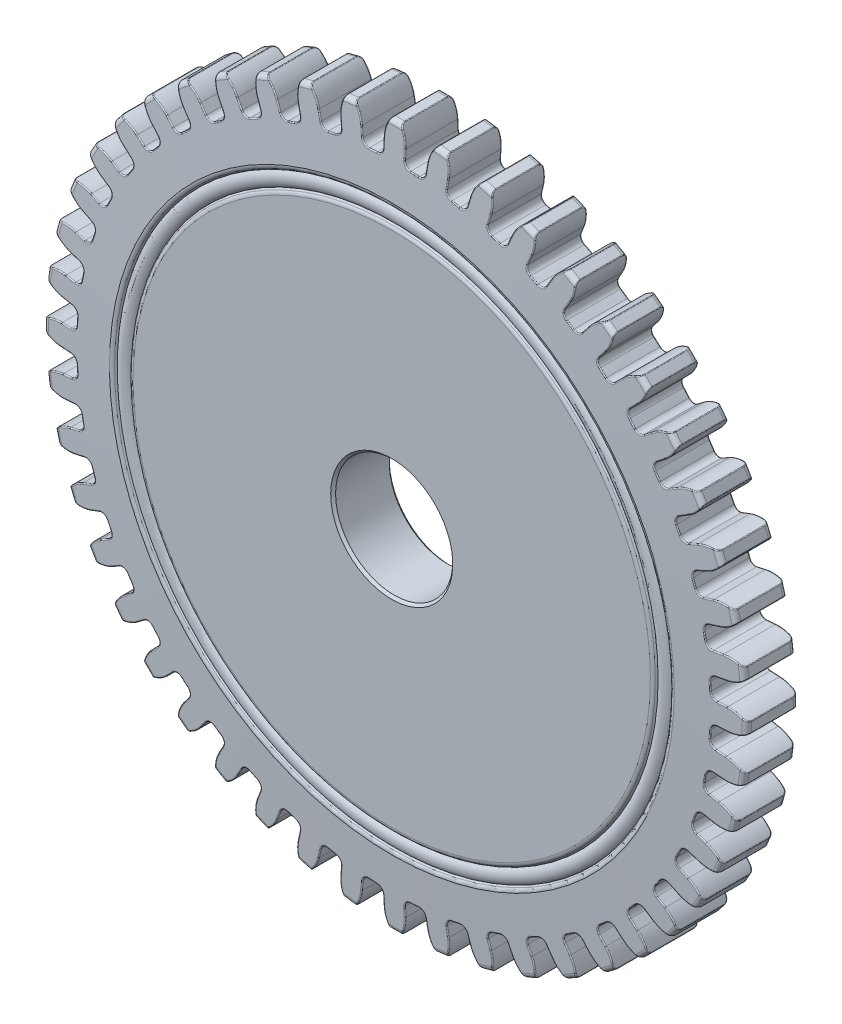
SolidWorks part; units mm, degrees
ref_plane "Спереди" through (0, 0, 0) normal (0, 0, 1) x (1, 0, 0)
ref_plane "Сверху" through (0, 0, 0) normal (0, 1, 0) x (1, 0, 0)
ref_plane "Справа" through (0, 0, 0) normal (1, 0, 0) x (0, 0, -1)
sketch "Эскиз1" plane through (0, 0, 0) normal (1, 0, 0) x (0, 0, -1)
  line L0 (0, 0) -> (8.0775, 0) construction
  line L1 (0, 0) -> (0, 36) construction
  line L2 (3, 6) -> (-3, 6)
  line L3 (-2.625, 36) -> (2.625, 36)
  line L4 (2.7071, 28.4071) -> (3, 28.7)
  line L5 (2.7071, 26.9929) -> (3, 26.7)
  line L6 (3, 6) -> (3, 26.7)
  line L7 (3, 28.7) -> (2.625, 36)
  line L8 (-3, 6) -> (-3, 26.7)
  line L9 (-2.7071, 26.9929) -> (-3, 26.7)
  line L10 (-2.7071, 28.4071) -> (-3, 28.7)
  line L11 (-3, 28.7) -> (-2.625, 36)
  arc A0 (2.7071, 26.9929) -> (2.7071, 28.4071) centre (2, 27.7) ccw
  arc A1 (-2.7071, 26.9929) -> (-2.7071, 28.4071) centre (-2, 27.7) cw
  point P9 (0, 6)
  dimension "D2" = 2
  dimension "D1" = 8.3
  dimension "D3" = 5.25
  dimension "D4" = 36
  dimension "D5" = 90
  dimension "D6" = 6
  dimension "D7" = 12
revolve "Повернуть1" add sketch "Эскиз1" angle 360 about L0
fillet "Скругление1" radius 0.5 4 edges at (36, 0, -2.625) (36, 0, 2.625) (26.7, 0, 3) (28.7, 0, 3)
chamfer "Фаска1" distance 0.25 angle 45 2 edges at (6, 0, 3) (6, 0, -3)
sketch "Эскиз2" plane through (0, 0, 0) normal (0, 0, 1) x (1, 0, 0)
  line L0 (0, 0) -> (0, 36) construction
  line L1 (-1.1, 34.0817) -> (-1.1, 33.0895)
  line L2 (1.1, 34.0817) -> (1.1, 33.0895)
  line L3 (3.358, 33.9337) -> (3.2285, 32.95)
  line L4 (5.5391, 33.6465) -> (5.4096, 32.6629)
  line L5 (7.7585, 33.2051) -> (7.5017, 32.2467)
  line L6 (9.8835, 32.6356) -> (9.6267, 31.6773)
  line L7 (12.0262, 31.9083) -> (11.6466, 30.9917)
  line L8 (14.0588, 31.0664) -> (13.6791, 30.1498)
  line L9 (16.0882, 30.0656) -> (15.5921, 29.2064)
  line L10 (17.9935, 28.9656) -> (17.4974, 28.1064)
  line L11 (19.8749, 27.7084) -> (19.271, 26.9213)
  line L12 (21.6203, 26.3692) -> (21.0163, 25.5821)
  line L13 (23.3216, 24.8772) -> (22.62, 24.1757)
  line L14 (24.8772, 23.3216) -> (24.1757, 22.62)
  line L15 (26.3692, 21.6203) -> (25.5821, 21.0163)
  line L16 (27.7084, 19.8749) -> (26.9213, 19.271)
  line L17 (28.9656, 17.9935) -> (28.1064, 17.4974)
  line L18 (30.0656, 16.0882) -> (29.2064, 15.5921)
  line L19 (31.0664, 14.0588) -> (30.1498, 13.6791)
  line L20 (31.9083, 12.0262) -> (30.9917, 11.6466)
  line L21 (32.6356, 9.8835) -> (31.6773, 9.6267)
  line L22 (33.2051, 7.7585) -> (32.2467, 7.5017)
  line L23 (33.6465, 5.5391) -> (32.6629, 5.4096)
  line L24 (33.9337, 3.358) -> (32.95, 3.2285)
  line L25 (34.0817, 1.1) -> (33.0895, 1.1)
  line L26 (34.0817, -1.1) -> (33.0895, -1.1)
  line L27 (33.9337, -3.358) -> (32.95, -3.2285)
  line L28 (33.6465, -5.5391) -> (32.6629, -5.4096)
  line L29 (33.2051, -7.7585) -> (32.2467, -7.5017)
  line L30 (32.6356, -9.8835) -> (31.6773, -9.6267)
  line L31 (31.9083, -12.0262) -> (30.9917, -11.6466)
  line L32 (31.0664, -14.0588) -> (30.1498, -13.6791)
  line L33 (30.0656, -16.0882) -> (29.2064, -15.5921)
  line L34 (28.9656, -17.9935) -> (28.1064, -17.4974)
  line L35 (27.7084, -19.8749) -> (26.9213, -19.271)
  line L36 (26.3692, -21.6203) -> (25.5821, -21.0163)
  line L37 (24.8772, -23.3216) -> (24.1757, -22.62)
  line L38 (23.3216, -24.8772) -> (22.62, -24.1757)
  line L39 (21.6203, -26.3692) -> (21.0163, -25.5821)
  line L40 (19.8749, -27.7084) -> (19.271, -26.9213)
  line L41 (17.9935, -28.9656) -> (17.4974, -28.1064)
  line L42 (16.0882, -30.0656) -> (15.5921, -29.2064)
  line L43 (14.0588, -31.0664) -> (13.6791, -30.1498)
  line L44 (12.0262, -31.9083) -> (11.6466, -30.9917)
  line L45 (9.8835, -32.6356) -> (9.6267, -31.6773)
  line L46 (7.7585, -33.2051) -> (7.5017, -32.2467)
  line L47 (5.5391, -33.6465) -> (5.4096, -32.6629)
  line L48 (3.358, -33.9337) -> (3.2285, -32.95)
  line L49 (1.1, -34.0817) -> (1.1, -33.0895)
  line L50 (-1.1, -34.0817) -> (-1.1, -33.0895)
  line L51 (-3.358, -33.9337) -> (-3.2285, -32.95)
  line L52 (-5.5391, -33.6465) -> (-5.4096, -32.6629)
  line L53 (-7.7585, -33.2051) -> (-7.5017, -32.2467)
  line L54 (-9.8835, -32.6356) -> (-9.6267, -31.6773)
  line L55 (-12.0262, -31.9083) -> (-11.6466, -30.9917)
  line L56 (-14.0588, -31.0664) -> (-13.6791, -30.1498)
  line L57 (-16.0882, -30.0656) -> (-15.5921, -29.2064)
  line L58 (-17.9935, -28.9656) -> (-17.4974, -28.1064)
  line L59 (-19.8749, -27.7084) -> (-19.271, -26.9213)
  line L60 (-21.6203, -26.3692) -> (-21.0163, -25.5821)
  line L61 (-23.3216, -24.8772) -> (-22.62, -24.1757)
  line L62 (-24.8772, -23.3216) -> (-24.1757, -22.62)
  line L63 (-26.3692, -21.6203) -> (-25.5821, -21.0163)
  line L64 (-27.7084, -19.8749) -> (-26.9213, -19.271)
  line L65 (-28.9656, -17.9935) -> (-28.1064, -17.4974)
  line L66 (-30.0656, -16.0882) -> (-29.2064, -15.5921)
  line L67 (-31.0664, -14.0588) -> (-30.1498, -13.6791)
  line L68 (-31.9083, -12.0262) -> (-30.9917, -11.6466)
  line L69 (-32.6356, -9.8835) -> (-31.6773, -9.6267)
  line L70 (-33.2051, -7.7585) -> (-32.2467, -7.5017)
  line L71 (-33.6465, -5.5391) -> (-32.6629, -5.4096)
  line L72 (-33.9337, -3.358) -> (-32.95, -3.2285)
  line L73 (-34.0817, -1.1) -> (-33.0895, -1.1)
  line L74 (-34.0817, 1.1) -> (-33.0895, 1.1)
  line L75 (-33.9337, 3.358) -> (-32.95, 3.2285)
  line L76 (-33.6465, 5.5391) -> (-32.6629, 5.4096)
  line L77 (-33.2051, 7.7585) -> (-32.2467, 7.5017)
  line L78 (-32.6356, 9.8835) -> (-31.6773, 9.6267)
  line L79 (-31.9083, 12.0262) -> (-30.9917, 11.6466)
  line L80 (-31.0664, 14.0588) -> (-30.1498, 13.6791)
  line L81 (-30.0656, 16.0882) -> (-29.2064, 15.5921)
  line L82 (-28.9656, 17.9935) -> (-28.1064, 17.4974)
  line L83 (-27.7084, 19.8749) -> (-26.9213, 19.271)
  line L84 (-26.3692, 21.6203) -> (-25.5821, 21.0163)
  line L85 (-24.8772, 23.3216) -> (-24.1757, 22.62)
  line L86 (-23.3216, 24.8772) -> (-22.62, 24.1757)
  line L87 (-21.6203, 26.3692) -> (-21.0163, 25.5821)
  line L88 (-19.8749, 27.7084) -> (-19.271, 26.9213)
  line L89 (-17.9935, 28.9656) -> (-17.4974, 28.1064)
  line L90 (-16.0882, 30.0656) -> (-15.5921, 29.2064)
  line L91 (-14.0588, 31.0664) -> (-13.6791, 30.1498)
  line L92 (-12.0262, 31.9083) -> (-11.6466, 30.9917)
  line L93 (-9.8835, 32.6356) -> (-9.6267, 31.6773)
  line L94 (-7.7585, 33.2051) -> (-7.5017, 32.2467)
  line L95 (-5.5391, 33.6465) -> (-5.4096, 32.6629)
  line L96 (-3.358, 33.9337) -> (-3.2285, 32.95)
  circle A0 centre (0, 0) radius 36 construction
  arc A1 (0.4762, 35.9969) -> (-0.4762, 35.9969) centre (0, 0) ccw
  circle A2 centre (0, 0) radius 33.75 construction
  arc A3 (-1.7018, 32.4554) -> (-2.5491, 32.3999) centre (0, 0) ccw
  arc A4 (-0.5595, 35.9502) -> (-1.1, 34.0817) centre (2.4, 34.0817) ccw
  arc A5 (0.5595, 35.9502) -> (1.1, 34.0817) centre (-2.4, 34.0817) cw
  arc A6 (1.1, 33.0895) -> (1.7018, 32.4554) centre (1.735, 33.0895) ccw
  arc A7 (-1.1, 33.0895) -> (-1.7018, 32.4554) centre (-1.735, 33.0895) cw
  arc A8 (0.5595, 35.9502) -> (0.4762, 35.9969) centre (0.4749, 35.8969) ccw
  arc A9 (-0.5595, 35.9502) -> (-0.4762, 35.9969) centre (-0.4749, 35.8969) cw
  arc A10 (5.1707, 35.6267) -> (4.2264, 35.7511) centre (0, 0) ccw
  arc A11 (4.1378, 35.7157) -> (3.358, 33.9337) centre (6.828, 33.4768) ccw
  arc A12 (5.2471, 35.5697) -> (5.5391, 33.6465) centre (2.0691, 34.1033) cw
  arc A13 (3.2285, 32.95) -> (2.5491, 32.3999) centre (2.5989, 33.0329) cw
  arc A14 (5.4096, 32.6629) -> (5.9235, 31.9556) centre (6.0392, 32.58) ccw
  arc A15 (4.1378, 35.7157) -> (4.2264, 35.7511) centre (4.2146, 35.6517) cw
  arc A16 (5.2471, 35.5697) -> (5.1707, 35.6267) centre (5.1563, 35.5278) ccw
  arc A17 (9.7767, 34.647) -> (8.8567, 34.8935) centre (0, 0) ccw
  arc A18 (8.7642, 34.8701) -> (7.7585, 33.2051) centre (11.1392, 32.2992) ccw
  arc A19 (9.845, 34.5805) -> (9.8835, 32.6356) centre (6.5028, 33.5415) cw
  arc A20 (7.5017, 32.2467) -> (6.7563, 31.79) centre (6.8883, 32.4111) cw
  arc A21 (9.6267, 31.6773) -> (10.0438, 30.9091) centre (10.2401, 31.513) ccw
  arc A22 (8.7642, 34.8701) -> (8.8567, 34.8935) centre (8.8321, 34.7966) cw
  arc A23 (9.845, 34.5805) -> (9.7767, 34.647) centre (9.7495, 34.5508) ccw
  arc A24 (14.2154, 33.0745) -> (13.3354, 33.439) centre (0, 0) ccw
  arc A25 (13.2407, 33.4278) -> (12.0262, 31.9083) centre (15.2598, 30.5689) ccw
  arc A26 (14.2744, 32.9996) -> (14.0588, 31.0664) centre (10.8252, 32.4058) cw
  arc A27 (11.6466, 30.9917) -> (10.8479, 30.6361) centre (11.0599, 31.2347) cw
  arc A28 (13.6791, 30.1498) -> (13.9924, 29.3337) centre (14.2658, 29.9068) ccw
  arc A29 (13.2407, 33.4278) -> (13.3354, 33.439) centre (13.2984, 33.3461) cw
  arc A30 (14.2744, 32.9996) -> (14.2154, 33.0745) centre (14.1759, 32.9826) ccw
  arc A31 (18.4108, 30.9361) -> (17.586, 31.4123) centre (0, 0) ccw
  arc A32 (17.4906, 31.4136) -> (16.0882, 30.0656) centre (19.1193, 28.3156) ccw
  arc A33 (18.4596, 30.8541) -> (17.9935, 28.9656) centre (14.9624, 30.7156) cw
  arc A34 (15.5921, 29.2064) -> (14.7539, 28.9581) centre (15.0422, 29.5239) cw
  arc A35 (17.4974, 28.1064) -> (17.7015, 27.2563) centre (18.0473, 27.7889) ccw
  arc A36 (17.4906, 31.4136) -> (17.586, 31.4123) centre (17.5372, 31.325) cw
  arc A37 (18.4596, 30.8541) -> (18.4108, 30.9361) centre (18.3597, 30.8501) ccw
  arc A38 (22.2913, 28.2683) -> (21.5357, 28.8481) centre (0, 0) ccw
  arc A39 (21.4413, 28.8618) -> (19.8749, 27.7084) centre (22.6516, 25.5778) ccw
  arc A40 (22.329, 28.1807) -> (21.6203, 26.3692) centre (18.8435, 28.4998) cw
  arc A41 (19.271, 26.9213) -> (18.4075, 26.7846) centre (18.7672, 27.3079) cw
  arc A42 (21.0163, 25.5821) -> (21.1077, 24.7127) centre (21.5201, 25.1955) ccw
  arc A43 (21.4413, 28.8618) -> (21.5357, 28.8481) centre (21.4759, 28.768) cw
  arc A44 (22.329, 28.1807) -> (22.2913, 28.2683) centre (22.2294, 28.1898) ccw
  arc A45 (25.7904, 25.1169) -> (25.1169, 25.7904) centre (0, 0) ccw
  arc A46 (25.0251, 25.8163) -> (23.3216, 24.8772) centre (25.7964, 22.4023) ccw
  arc A47 (25.8163, 25.0251) -> (24.8772, 23.3216) centre (22.4023, 25.7964) cw
  arc A48 (22.62, 24.1757) -> (21.7461, 24.1528) centre (22.171, 24.6247) cw
  arc A49 (24.1757, 22.62) -> (24.1528, 21.7461) centre (24.6247, 22.171) ccw
  arc A50 (25.0251, 25.8163) -> (25.1169, 25.7904) centre (25.0471, 25.7187) cw
  arc A51 (25.8163, 25.0251) -> (25.7904, 25.1169) centre (25.7187, 25.0471) ccw
  arc A52 (28.8481, 21.5357) -> (28.2683, 22.2913) centre (0, 0) ccw
  arc A53 (28.1807, 22.329) -> (26.3692, 21.6203) centre (28.4998, 18.8435) ccw
  arc A54 (28.8618, 21.4413) -> (27.7084, 19.8749) centre (25.5778, 22.6516) cw
  arc A55 (25.5821, 21.0163) -> (24.7127, 21.1077) centre (25.1955, 21.5201) cw
  arc A56 (26.9213, 19.271) -> (26.7846, 18.4075) centre (27.3079, 18.7672) ccw
  arc A57 (28.1807, 22.329) -> (28.2683, 22.2913) centre (28.1898, 22.2294) cw
  arc A58 (28.8618, 21.4413) -> (28.8481, 21.5357) centre (28.768, 21.4759) ccw
  arc A59 (31.4123, 17.586) -> (30.9361, 18.4108) centre (0, 0) ccw
  arc A60 (30.8541, 18.4596) -> (28.9656, 17.9935) centre (30.7156, 14.9624) ccw
  arc A61 (31.4136, 17.4906) -> (30.0656, 16.0882) centre (28.3156, 19.1193) cw
  arc A62 (28.1064, 17.4974) -> (27.2563, 17.7015) centre (27.7889, 18.0473) cw
  arc A63 (29.2064, 15.5921) -> (28.9581, 14.7539) centre (29.5239, 15.0422) ccw
  arc A64 (30.8541, 18.4596) -> (30.9361, 18.4108) centre (30.8501, 18.3597) cw
  arc A65 (31.4136, 17.4906) -> (31.4123, 17.586) centre (31.325, 17.5372) ccw
  arc A66 (33.439, 13.3354) -> (33.0745, 14.2154) centre (0, 0) ccw
  arc A67 (32.9996, 14.2744) -> (31.0664, 14.0588) centre (32.4058, 10.8252) ccw
  arc A68 (33.4278, 13.2407) -> (31.9083, 12.0262) centre (30.5689, 15.2598) cw
  arc A69 (30.1498, 13.6791) -> (29.3337, 13.9924) centre (29.9068, 14.2658) cw
  arc A70 (30.9917, 11.6466) -> (30.6361, 10.8479) centre (31.2347, 11.0599) ccw
  arc A71 (32.9996, 14.2744) -> (33.0745, 14.2154) centre (32.9826, 14.1759) cw
  arc A72 (33.4278, 13.2407) -> (33.439, 13.3354) centre (33.3461, 13.2984) ccw
  arc A73 (34.8935, 8.8567) -> (34.647, 9.7767) centre (0, 0) ccw
  arc A74 (34.5805, 9.845) -> (32.6356, 9.8835) centre (33.5415, 6.5028) ccw
  arc A75 (34.8701, 8.7642) -> (33.2051, 7.7585) centre (32.2992, 11.1392) cw
  arc A76 (31.6773, 9.6267) -> (30.9091, 10.0438) centre (31.513, 10.2401) cw
  arc A77 (32.2467, 7.5017) -> (31.79, 6.7563) centre (32.4111, 6.8883) ccw
  arc A78 (34.5805, 9.845) -> (34.647, 9.7767) centre (34.5508, 9.7495) cw
  arc A79 (34.8701, 8.7642) -> (34.8935, 8.8567) centre (34.7966, 8.8321) ccw
  arc A80 (35.7511, 4.2264) -> (35.6267, 5.1707) centre (0, 0) ccw
  arc A81 (35.5697, 5.2471) -> (33.6465, 5.5391) centre (34.1033, 2.0691) ccw
  arc A82 (35.7157, 4.1378) -> (33.9337, 3.358) centre (33.4768, 6.828) cw
  arc A83 (32.6629, 5.4096) -> (31.9556, 5.9235) centre (32.58, 6.0392) cw
  arc A84 (32.95, 3.2285) -> (32.3999, 2.5491) centre (33.0329, 2.5989) ccw
  arc A85 (35.5697, 5.2471) -> (35.6267, 5.1707) centre (35.5278, 5.1563) cw
  arc A86 (35.7157, 4.1378) -> (35.7511, 4.2264) centre (35.6517, 4.2146) ccw
  arc A87 (35.9969, -0.4762) -> (35.9969, 0.4762) centre (0, 0) ccw
  arc A88 (35.9502, 0.5595) -> (34.0817, 1.1) centre (34.0817, -2.4) ccw
  arc A89 (35.9502, -0.5595) -> (34.0817, -1.1) centre (34.0817, 2.4) cw
  arc A90 (33.0895, 1.1) -> (32.4554, 1.7018) centre (33.0895, 1.735) cw
  arc A91 (33.0895, -1.1) -> (32.4554, -1.7018) centre (33.0895, -1.735) ccw
  arc A92 (35.9502, 0.5595) -> (35.9969, 0.4762) centre (35.8969, 0.4749) cw
  arc A93 (35.9502, -0.5595) -> (35.9969, -0.4762) centre (35.8969, -0.4749) ccw
  arc A94 (35.6267, -5.1707) -> (35.7511, -4.2264) centre (0, 0) ccw
  arc A95 (35.7157, -4.1378) -> (33.9337, -3.358) centre (33.4768, -6.828) ccw
  arc A96 (35.5697, -5.2471) -> (33.6465, -5.5391) centre (34.1033, -2.0691) cw
  arc A97 (32.95, -3.2285) -> (32.3999, -2.5491) centre (33.0329, -2.5989) cw
  arc A98 (32.6629, -5.4096) -> (31.9556, -5.9235) centre (32.58, -6.0392) ccw
  arc A99 (35.7157, -4.1378) -> (35.7511, -4.2264) centre (35.6517, -4.2146) cw
  arc A100 (35.5697, -5.2471) -> (35.6267, -5.1707) centre (35.5278, -5.1563) ccw
  arc A101 (34.647, -9.7767) -> (34.8935, -8.8567) centre (0, 0) ccw
  arc A102 (34.8701, -8.7642) -> (33.2051, -7.7585) centre (32.2992, -11.1392) ccw
  arc A103 (34.5805, -9.845) -> (32.6356, -9.8835) centre (33.5415, -6.5028) cw
  arc A104 (32.2467, -7.5017) -> (31.79, -6.7563) centre (32.4111, -6.8883) cw
  arc A105 (31.6773, -9.6267) -> (30.9091, -10.0438) centre (31.513, -10.2401) ccw
  arc A106 (34.8701, -8.7642) -> (34.8935, -8.8567) centre (34.7966, -8.8321) cw
  arc A107 (34.5805, -9.845) -> (34.647, -9.7767) centre (34.5508, -9.7495) ccw
  arc A108 (33.0745, -14.2154) -> (33.439, -13.3354) centre (0, 0) ccw
  arc A109 (33.4278, -13.2407) -> (31.9083, -12.0262) centre (30.5689, -15.2598) ccw
  arc A110 (32.9996, -14.2744) -> (31.0664, -14.0588) centre (32.4058, -10.8252) cw
  arc A111 (30.9917, -11.6466) -> (30.6361, -10.8479) centre (31.2347, -11.0599) cw
  arc A112 (30.1498, -13.6791) -> (29.3337, -13.9924) centre (29.9068, -14.2658) ccw
  arc A113 (33.4278, -13.2407) -> (33.439, -13.3354) centre (33.3461, -13.2984) cw
  arc A114 (32.9996, -14.2744) -> (33.0745, -14.2154) centre (32.9826, -14.1759) ccw
  arc A115 (30.9361, -18.4108) -> (31.4123, -17.586) centre (0, 0) ccw
  arc A116 (31.4136, -17.4906) -> (30.0656, -16.0882) centre (28.3156, -19.1193) ccw
  arc A117 (30.8541, -18.4596) -> (28.9656, -17.9935) centre (30.7156, -14.9624) cw
  arc A118 (29.2064, -15.5921) -> (28.9581, -14.7539) centre (29.5239, -15.0422) cw
  arc A119 (28.1064, -17.4974) -> (27.2563, -17.7015) centre (27.7889, -18.0473) ccw
  arc A120 (31.4136, -17.4906) -> (31.4123, -17.586) centre (31.325, -17.5372) cw
  arc A121 (30.8541, -18.4596) -> (30.9361, -18.4108) centre (30.8501, -18.3597) ccw
  arc A122 (28.2683, -22.2913) -> (28.8481, -21.5357) centre (0, 0) ccw
  arc A123 (28.8618, -21.4413) -> (27.7084, -19.8749) centre (25.5778, -22.6516) ccw
  arc A124 (28.1807, -22.329) -> (26.3692, -21.6203) centre (28.4998, -18.8435) cw
  arc A125 (26.9213, -19.271) -> (26.7846, -18.4075) centre (27.3079, -18.7672) cw
  arc A126 (25.5821, -21.0163) -> (24.7127, -21.1077) centre (25.1955, -21.5201) ccw
  arc A127 (28.8618, -21.4413) -> (28.8481, -21.5357) centre (28.768, -21.4759) cw
  arc A128 (28.1807, -22.329) -> (28.2683, -22.2913) centre (28.1898, -22.2294) ccw
  arc A129 (25.1169, -25.7904) -> (25.7904, -25.1169) centre (0, 0) ccw
  arc A130 (25.8163, -25.0251) -> (24.8772, -23.3216) centre (22.4023, -25.7964) ccw
  arc A131 (25.0251, -25.8163) -> (23.3216, -24.8772) centre (25.7964, -22.4023) cw
  arc A132 (24.1757, -22.62) -> (24.1528, -21.7461) centre (24.6247, -22.171) cw
  arc A133 (22.62, -24.1757) -> (21.7461, -24.1528) centre (22.171, -24.6247) ccw
  arc A134 (25.8163, -25.0251) -> (25.7904, -25.1169) centre (25.7187, -25.0471) cw
  arc A135 (25.0251, -25.8163) -> (25.1169, -25.7904) centre (25.0471, -25.7187) ccw
  arc A136 (21.5357, -28.8481) -> (22.2913, -28.2683) centre (0, 0) ccw
  arc A137 (22.329, -28.1807) -> (21.6203, -26.3692) centre (18.8435, -28.4998) ccw
  arc A138 (21.4413, -28.8618) -> (19.8749, -27.7084) centre (22.6516, -25.5778) cw
  arc A139 (21.0163, -25.5821) -> (21.1077, -24.7127) centre (21.5201, -25.1955) cw
  arc A140 (19.271, -26.9213) -> (18.4075, -26.7846) centre (18.7672, -27.3079) ccw
  arc A141 (22.329, -28.1807) -> (22.2913, -28.2683) centre (22.2294, -28.1898) cw
  arc A142 (21.4413, -28.8618) -> (21.5357, -28.8481) centre (21.4759, -28.768) ccw
  arc A143 (17.586, -31.4123) -> (18.4108, -30.9361) centre (0, 0) ccw
  arc A144 (18.4596, -30.8541) -> (17.9935, -28.9656) centre (14.9624, -30.7156) ccw
  arc A145 (17.4906, -31.4136) -> (16.0882, -30.0656) centre (19.1193, -28.3156) cw
  arc A146 (17.4974, -28.1064) -> (17.7015, -27.2563) centre (18.0473, -27.7889) cw
  arc A147 (15.5921, -29.2064) -> (14.7539, -28.9581) centre (15.0422, -29.5239) ccw
  arc A148 (18.4596, -30.8541) -> (18.4108, -30.9361) centre (18.3597, -30.8501) cw
  arc A149 (17.4906, -31.4136) -> (17.586, -31.4123) centre (17.5372, -31.325) ccw
  arc A150 (13.3354, -33.439) -> (14.2154, -33.0745) centre (0, 0) ccw
  arc A151 (14.2744, -32.9996) -> (14.0588, -31.0664) centre (10.8252, -32.4058) ccw
  arc A152 (13.2407, -33.4278) -> (12.0262, -31.9083) centre (15.2598, -30.5689) cw
  arc A153 (13.6791, -30.1498) -> (13.9924, -29.3337) centre (14.2658, -29.9068) cw
  arc A154 (11.6466, -30.9917) -> (10.8479, -30.6361) centre (11.0599, -31.2347) ccw
  arc A155 (14.2744, -32.9996) -> (14.2154, -33.0745) centre (14.1759, -32.9826) cw
  arc A156 (13.2407, -33.4278) -> (13.3354, -33.439) centre (13.2984, -33.3461) ccw
  arc A157 (8.8567, -34.8935) -> (9.7767, -34.647) centre (0, 0) ccw
  arc A158 (9.845, -34.5805) -> (9.8835, -32.6356) centre (6.5028, -33.5415) ccw
  arc A159 (8.7642, -34.8701) -> (7.7585, -33.2051) centre (11.1392, -32.2992) cw
  arc A160 (9.6267, -31.6773) -> (10.0438, -30.9091) centre (10.2401, -31.513) cw
  arc A161 (7.5017, -32.2467) -> (6.7563, -31.79) centre (6.8883, -32.4111) ccw
  arc A162 (9.845, -34.5805) -> (9.7767, -34.647) centre (9.7495, -34.5508) cw
  arc A163 (8.7642, -34.8701) -> (8.8567, -34.8935) centre (8.8321, -34.7966) ccw
  arc A164 (4.2264, -35.7511) -> (5.1707, -35.6267) centre (0, 0) ccw
  arc A165 (5.2471, -35.5697) -> (5.5391, -33.6465) centre (2.0691, -34.1033) ccw
  arc A166 (4.1378, -35.7157) -> (3.358, -33.9337) centre (6.828, -33.4768) cw
  arc A167 (5.4096, -32.6629) -> (5.9235, -31.9556) centre (6.0392, -32.58) cw
  arc A168 (3.2285, -32.95) -> (2.5491, -32.3999) centre (2.5989, -33.0329) ccw
  arc A169 (5.2471, -35.5697) -> (5.1707, -35.6267) centre (5.1563, -35.5278) cw
  arc A170 (4.1378, -35.7157) -> (4.2264, -35.7511) centre (4.2146, -35.6517) ccw
  arc A171 (-0.4762, -35.9969) -> (0.4762, -35.9969) centre (0, 0) ccw
  arc A172 (0.5595, -35.9502) -> (1.1, -34.0817) centre (-2.4, -34.0817) ccw
  arc A173 (-0.5595, -35.9502) -> (-1.1, -34.0817) centre (2.4, -34.0817) cw
  arc A174 (1.1, -33.0895) -> (1.7018, -32.4554) centre (1.735, -33.0895) cw
  arc A175 (-1.1, -33.0895) -> (-1.7018, -32.4554) centre (-1.735, -33.0895) ccw
  arc A176 (0.5595, -35.9502) -> (0.4762, -35.9969) centre (0.4749, -35.8969) cw
  arc A177 (-0.5595, -35.9502) -> (-0.4762, -35.9969) centre (-0.4749, -35.8969) ccw
  arc A178 (-5.1707, -35.6267) -> (-4.2264, -35.7511) centre (0, 0) ccw
  arc A179 (-4.1378, -35.7157) -> (-3.358, -33.9337) centre (-6.828, -33.4768) ccw
  arc A180 (-5.2471, -35.5697) -> (-5.5391, -33.6465) centre (-2.0691, -34.1033) cw
  arc A181 (-3.2285, -32.95) -> (-2.5491, -32.3999) centre (-2.5989, -33.0329) cw
  arc A182 (-5.4096, -32.6629) -> (-5.9235, -31.9556) centre (-6.0392, -32.58) ccw
  arc A183 (-4.1378, -35.7157) -> (-4.2264, -35.7511) centre (-4.2146, -35.6517) cw
  arc A184 (-5.2471, -35.5697) -> (-5.1707, -35.6267) centre (-5.1563, -35.5278) ccw
  arc A185 (-9.7767, -34.647) -> (-8.8567, -34.8935) centre (0, 0) ccw
  arc A186 (-8.7642, -34.8701) -> (-7.7585, -33.2051) centre (-11.1392, -32.2992) ccw
  arc A187 (-9.845, -34.5805) -> (-9.8835, -32.6356) centre (-6.5028, -33.5415) cw
  arc A188 (-7.5017, -32.2467) -> (-6.7563, -31.79) centre (-6.8883, -32.4111) cw
  arc A189 (-9.6267, -31.6773) -> (-10.0438, -30.9091) centre (-10.2401, -31.513) ccw
  arc A190 (-8.7642, -34.8701) -> (-8.8567, -34.8935) centre (-8.8321, -34.7966) cw
  arc A191 (-9.845, -34.5805) -> (-9.7767, -34.647) centre (-9.7495, -34.5508) ccw
  arc A192 (-14.2154, -33.0745) -> (-13.3354, -33.439) centre (0, 0) ccw
  arc A193 (-13.2407, -33.4278) -> (-12.0262, -31.9083) centre (-15.2598, -30.5689) ccw
  arc A194 (-14.2744, -32.9996) -> (-14.0588, -31.0664) centre (-10.8252, -32.4058) cw
  arc A195 (-11.6466, -30.9917) -> (-10.8479, -30.6361) centre (-11.0599, -31.2347) cw
  arc A196 (-13.6791, -30.1498) -> (-13.9924, -29.3337) centre (-14.2658, -29.9068) ccw
  arc A197 (-13.2407, -33.4278) -> (-13.3354, -33.439) centre (-13.2984, -33.3461) cw
  arc A198 (-14.2744, -32.9996) -> (-14.2154, -33.0745) centre (-14.1759, -32.9826) ccw
  arc A199 (-18.4108, -30.9361) -> (-17.586, -31.4123) centre (0, 0) ccw
  arc A200 (-17.4906, -31.4136) -> (-16.0882, -30.0656) centre (-19.1193, -28.3156) ccw
  arc A201 (-18.4596, -30.8541) -> (-17.9935, -28.9656) centre (-14.9624, -30.7156) cw
  arc A202 (-15.5921, -29.2064) -> (-14.7539, -28.9581) centre (-15.0422, -29.5239) cw
  arc A203 (-17.4974, -28.1064) -> (-17.7015, -27.2563) centre (-18.0473, -27.7889) ccw
  arc A204 (-17.4906, -31.4136) -> (-17.586, -31.4123) centre (-17.5372, -31.325) cw
  arc A205 (-18.4596, -30.8541) -> (-18.4108, -30.9361) centre (-18.3597, -30.8501) ccw
  arc A206 (-22.2913, -28.2683) -> (-21.5357, -28.8481) centre (0, 0) ccw
  arc A207 (-21.4413, -28.8618) -> (-19.8749, -27.7084) centre (-22.6516, -25.5778) ccw
  arc A208 (-22.329, -28.1807) -> (-21.6203, -26.3692) centre (-18.8435, -28.4998) cw
  arc A209 (-19.271, -26.9213) -> (-18.4075, -26.7846) centre (-18.7672, -27.3079) cw
  arc A210 (-21.0163, -25.5821) -> (-21.1077, -24.7127) centre (-21.5201, -25.1955) ccw
  arc A211 (-21.4413, -28.8618) -> (-21.5357, -28.8481) centre (-21.4759, -28.768) cw
  arc A212 (-22.329, -28.1807) -> (-22.2913, -28.2683) centre (-22.2294, -28.1898) ccw
  arc A213 (-25.7904, -25.1169) -> (-25.1169, -25.7904) centre (0, 0) ccw
  arc A214 (-25.0251, -25.8163) -> (-23.3216, -24.8772) centre (-25.7964, -22.4023) ccw
  arc A215 (-25.8163, -25.0251) -> (-24.8772, -23.3216) centre (-22.4023, -25.7964) cw
  arc A216 (-22.62, -24.1757) -> (-21.7461, -24.1528) centre (-22.171, -24.6247) cw
  arc A217 (-24.1757, -22.62) -> (-24.1528, -21.7461) centre (-24.6247, -22.171) ccw
  arc A218 (-25.0251, -25.8163) -> (-25.1169, -25.7904) centre (-25.0471, -25.7187) cw
  arc A219 (-25.8163, -25.0251) -> (-25.7904, -25.1169) centre (-25.7187, -25.0471) ccw
  arc A220 (-28.8481, -21.5357) -> (-28.2683, -22.2913) centre (0, 0) ccw
  arc A221 (-28.1807, -22.329) -> (-26.3692, -21.6203) centre (-28.4998, -18.8435) ccw
  arc A222 (-28.8618, -21.4413) -> (-27.7084, -19.8749) centre (-25.5778, -22.6516) cw
  arc A223 (-25.5821, -21.0163) -> (-24.7127, -21.1077) centre (-25.1955, -21.5201) cw
  arc A224 (-26.9213, -19.271) -> (-26.7846, -18.4075) centre (-27.3079, -18.7672) ccw
  arc A225 (-28.1807, -22.329) -> (-28.2683, -22.2913) centre (-28.1898, -22.2294) cw
  arc A226 (-28.8618, -21.4413) -> (-28.8481, -21.5357) centre (-28.768, -21.4759) ccw
  arc A227 (-31.4123, -17.586) -> (-30.9361, -18.4108) centre (0, 0) ccw
  arc A228 (-30.8541, -18.4596) -> (-28.9656, -17.9935) centre (-30.7156, -14.9624) ccw
  arc A229 (-31.4136, -17.4906) -> (-30.0656, -16.0882) centre (-28.3156, -19.1193) cw
  arc A230 (-28.1064, -17.4974) -> (-27.2563, -17.7015) centre (-27.7889, -18.0473) cw
  arc A231 (-29.2064, -15.5921) -> (-28.9581, -14.7539) centre (-29.5239, -15.0422) ccw
  arc A232 (-30.8541, -18.4596) -> (-30.9361, -18.4108) centre (-30.8501, -18.3597) cw
  arc A233 (-31.4136, -17.4906) -> (-31.4123, -17.586) centre (-31.325, -17.5372) ccw
  arc A234 (-33.439, -13.3354) -> (-33.0745, -14.2154) centre (0, 0) ccw
  arc A235 (-32.9996, -14.2744) -> (-31.0664, -14.0588) centre (-32.4058, -10.8252) ccw
  arc A236 (-33.4278, -13.2407) -> (-31.9083, -12.0262) centre (-30.5689, -15.2598) cw
  arc A237 (-30.1498, -13.6791) -> (-29.3337, -13.9924) centre (-29.9068, -14.2658) cw
  arc A238 (-30.9917, -11.6466) -> (-30.6361, -10.8479) centre (-31.2347, -11.0599) ccw
  arc A239 (-32.9996, -14.2744) -> (-33.0745, -14.2154) centre (-32.9826, -14.1759) cw
  arc A240 (-33.4278, -13.2407) -> (-33.439, -13.3354) centre (-33.3461, -13.2984) ccw
  arc A241 (-34.8935, -8.8567) -> (-34.647, -9.7767) centre (0, 0) ccw
  arc A242 (-34.5805, -9.845) -> (-32.6356, -9.8835) centre (-33.5415, -6.5028) ccw
  arc A243 (-34.8701, -8.7642) -> (-33.2051, -7.7585) centre (-32.2992, -11.1392) cw
  arc A244 (-31.6773, -9.6267) -> (-30.9091, -10.0438) centre (-31.513, -10.2401) cw
  arc A245 (-32.2467, -7.5017) -> (-31.79, -6.7563) centre (-32.4111, -6.8883) ccw
  arc A246 (-34.5805, -9.845) -> (-34.647, -9.7767) centre (-34.5508, -9.7495) cw
  arc A247 (-34.8701, -8.7642) -> (-34.8935, -8.8567) centre (-34.7966, -8.8321) ccw
  arc A248 (-35.7511, -4.2264) -> (-35.6267, -5.1707) centre (0, 0) ccw
  arc A249 (-35.5697, -5.2471) -> (-33.6465, -5.5391) centre (-34.1033, -2.0691) ccw
  arc A250 (-35.7157, -4.1378) -> (-33.9337, -3.358) centre (-33.4768, -6.828) cw
  arc A251 (-32.6629, -5.4096) -> (-31.9556, -5.9235) centre (-32.58, -6.0392) cw
  arc A252 (-32.95, -3.2285) -> (-32.3999, -2.5491) centre (-33.0329, -2.5989) ccw
  arc A253 (-35.5697, -5.2471) -> (-35.6267, -5.1707) centre (-35.5278, -5.1563) cw
  arc A254 (-35.7157, -4.1378) -> (-35.7511, -4.2264) centre (-35.6517, -4.2146) ccw
  arc A255 (-35.9969, 0.4762) -> (-35.9969, -0.4762) centre (0, 0) ccw
  arc A256 (-35.9502, -0.5595) -> (-34.0817, -1.1) centre (-34.0817, 2.4) ccw
  arc A257 (-35.9502, 0.5595) -> (-34.0817, 1.1) centre (-34.0817, -2.4) cw
  arc A258 (-33.0895, -1.1) -> (-32.4554, -1.7018) centre (-33.0895, -1.735) cw
  arc A259 (-33.0895, 1.1) -> (-32.4554, 1.7018) centre (-33.0895, 1.735) ccw
  arc A260 (-35.9502, -0.5595) -> (-35.9969, -0.4762) centre (-35.8969, -0.4749) cw
  arc A261 (-35.9502, 0.5595) -> (-35.9969, 0.4762) centre (-35.8969, 0.4749) ccw
  arc A262 (-35.6267, 5.1707) -> (-35.7511, 4.2264) centre (0, 0) ccw
  arc A263 (-35.7157, 4.1378) -> (-33.9337, 3.358) centre (-33.4768, 6.828) ccw
  arc A264 (-35.5697, 5.2471) -> (-33.6465, 5.5391) centre (-34.1033, 2.0691) cw
  arc A265 (-32.95, 3.2285) -> (-32.3999, 2.5491) centre (-33.0329, 2.5989) cw
  arc A266 (-32.6629, 5.4096) -> (-31.9556, 5.9235) centre (-32.58, 6.0392) ccw
  arc A267 (-35.7157, 4.1378) -> (-35.7511, 4.2264) centre (-35.6517, 4.2146) cw
  arc A268 (-35.5697, 5.2471) -> (-35.6267, 5.1707) centre (-35.5278, 5.1563) ccw
  arc A269 (-34.647, 9.7767) -> (-34.8935, 8.8567) centre (0, 0) ccw
  arc A270 (-34.8701, 8.7642) -> (-33.2051, 7.7585) centre (-32.2992, 11.1392) ccw
  arc A271 (-34.5805, 9.845) -> (-32.6356, 9.8835) centre (-33.5415, 6.5028) cw
  arc A272 (-32.2467, 7.5017) -> (-31.79, 6.7563) centre (-32.4111, 6.8883) cw
  arc A273 (-31.6773, 9.6267) -> (-30.9091, 10.0438) centre (-31.513, 10.2401) ccw
  arc A274 (-34.8701, 8.7642) -> (-34.8935, 8.8567) centre (-34.7966, 8.8321) cw
  arc A275 (-34.5805, 9.845) -> (-34.647, 9.7767) centre (-34.5508, 9.7495) ccw
  arc A276 (-33.0745, 14.2154) -> (-33.439, 13.3354) centre (0, 0) ccw
  arc A277 (-33.4278, 13.2407) -> (-31.9083, 12.0262) centre (-30.5689, 15.2598) ccw
  arc A278 (-32.9996, 14.2744) -> (-31.0664, 14.0588) centre (-32.4058, 10.8252) cw
  arc A279 (-30.9917, 11.6466) -> (-30.6361, 10.8479) centre (-31.2347, 11.0599) cw
  arc A280 (-30.1498, 13.6791) -> (-29.3337, 13.9924) centre (-29.9068, 14.2658) ccw
  arc A281 (-33.4278, 13.2407) -> (-33.439, 13.3354) centre (-33.3461, 13.2984) cw
  arc A282 (-32.9996, 14.2744) -> (-33.0745, 14.2154) centre (-32.9826, 14.1759) ccw
  arc A283 (-30.9361, 18.4108) -> (-31.4123, 17.586) centre (0, 0) ccw
  arc A284 (-31.4136, 17.4906) -> (-30.0656, 16.0882) centre (-28.3156, 19.1193) ccw
  arc A285 (-30.8541, 18.4596) -> (-28.9656, 17.9935) centre (-30.7156, 14.9624) cw
  arc A286 (-29.2064, 15.5921) -> (-28.9581, 14.7539) centre (-29.5239, 15.0422) cw
  arc A287 (-28.1064, 17.4974) -> (-27.2563, 17.7015) centre (-27.7889, 18.0473) ccw
  arc A288 (-31.4136, 17.4906) -> (-31.4123, 17.586) centre (-31.325, 17.5372) cw
  arc A289 (-30.8541, 18.4596) -> (-30.9361, 18.4108) centre (-30.8501, 18.3597) ccw
  arc A290 (-28.2683, 22.2913) -> (-28.8481, 21.5357) centre (0, 0) ccw
  arc A291 (-28.8618, 21.4413) -> (-27.7084, 19.8749) centre (-25.5778, 22.6516) ccw
  arc A292 (-28.1807, 22.329) -> (-26.3692, 21.6203) centre (-28.4998, 18.8435) cw
  arc A293 (-26.9213, 19.271) -> (-26.7846, 18.4075) centre (-27.3079, 18.7672) cw
  arc A294 (-25.5821, 21.0163) -> (-24.7127, 21.1077) centre (-25.1955, 21.5201) ccw
  arc A295 (-28.8618, 21.4413) -> (-28.8481, 21.5357) centre (-28.768, 21.4759) cw
  arc A296 (-28.1807, 22.329) -> (-28.2683, 22.2913) centre (-28.1898, 22.2294) ccw
  arc A297 (-25.1169, 25.7904) -> (-25.7904, 25.1169) centre (0, 0) ccw
  arc A298 (-25.8163, 25.0251) -> (-24.8772, 23.3216) centre (-22.4023, 25.7964) ccw
  arc A299 (-25.0251, 25.8163) -> (-23.3216, 24.8772) centre (-25.7964, 22.4023) cw
  arc A300 (-24.1757, 22.62) -> (-24.1528, 21.7461) centre (-24.6247, 22.171) cw
  arc A301 (-22.62, 24.1757) -> (-21.7461, 24.1528) centre (-22.171, 24.6247) ccw
  arc A302 (-25.8163, 25.0251) -> (-25.7904, 25.1169) centre (-25.7187, 25.0471) cw
  arc A303 (-25.0251, 25.8163) -> (-25.1169, 25.7904) centre (-25.0471, 25.7187) ccw
  arc A304 (-21.5357, 28.8481) -> (-22.2913, 28.2683) centre (0, 0) ccw
  arc A305 (-22.329, 28.1807) -> (-21.6203, 26.3692) centre (-18.8435, 28.4998) ccw
  arc A306 (-21.4413, 28.8618) -> (-19.8749, 27.7084) centre (-22.6516, 25.5778) cw
  arc A307 (-21.0163, 25.5821) -> (-21.1077, 24.7127) centre (-21.5201, 25.1955) cw
  arc A308 (-19.271, 26.9213) -> (-18.4075, 26.7846) centre (-18.7672, 27.3079) ccw
  arc A309 (-22.329, 28.1807) -> (-22.2913, 28.2683) centre (-22.2294, 28.1898) cw
  arc A310 (-21.4413, 28.8618) -> (-21.5357, 28.8481) centre (-21.4759, 28.768) ccw
  arc A311 (-17.586, 31.4123) -> (-18.4108, 30.9361) centre (0, 0) ccw
  arc A312 (-18.4596, 30.8541) -> (-17.9935, 28.9656) centre (-14.9624, 30.7156) ccw
  arc A313 (-17.4906, 31.4136) -> (-16.0882, 30.0656) centre (-19.1193, 28.3156) cw
  arc A314 (-17.4974, 28.1064) -> (-17.7015, 27.2563) centre (-18.0473, 27.7889) cw
  arc A315 (-15.5921, 29.2064) -> (-14.7539, 28.9581) centre (-15.0422, 29.5239) ccw
  arc A316 (-18.4596, 30.8541) -> (-18.4108, 30.9361) centre (-18.3597, 30.8501) cw
  arc A317 (-17.4906, 31.4136) -> (-17.586, 31.4123) centre (-17.5372, 31.325) ccw
  arc A318 (-13.3354, 33.439) -> (-14.2154, 33.0745) centre (0, 0) ccw
  arc A319 (-14.2744, 32.9996) -> (-14.0588, 31.0664) centre (-10.8252, 32.4058) ccw
  arc A320 (-13.2407, 33.4278) -> (-12.0262, 31.9083) centre (-15.2598, 30.5689) cw
  arc A321 (-13.6791, 30.1498) -> (-13.9924, 29.3337) centre (-14.2658, 29.9068) cw
  arc A322 (-11.6466, 30.9917) -> (-10.8479, 30.6361) centre (-11.0599, 31.2347) ccw
  arc A323 (-14.2744, 32.9996) -> (-14.2154, 33.0745) centre (-14.1759, 32.9826) cw
  arc A324 (-13.2407, 33.4278) -> (-13.3354, 33.439) centre (-13.2984, 33.3461) ccw
  arc A325 (-8.8567, 34.8935) -> (-9.7767, 34.647) centre (0, 0) ccw
  arc A326 (-9.845, 34.5805) -> (-9.8835, 32.6356) centre (-6.5028, 33.5415) ccw
  arc A327 (-8.7642, 34.8701) -> (-7.7585, 33.2051) centre (-11.1392, 32.2992) cw
  arc A328 (-9.6267, 31.6773) -> (-10.0438, 30.9091) centre (-10.2401, 31.513) cw
  arc A329 (-7.5017, 32.2467) -> (-6.7563, 31.79) centre (-6.8883, 32.4111) ccw
  arc A330 (-9.845, 34.5805) -> (-9.7767, 34.647) centre (-9.7495, 34.5508) cw
  arc A331 (-8.7642, 34.8701) -> (-8.8567, 34.8935) centre (-8.8321, 34.7966) ccw
  arc A332 (-4.2264, 35.7511) -> (-5.1707, 35.6267) centre (0, 0) ccw
  arc A333 (-5.2471, 35.5697) -> (-5.5391, 33.6465) centre (-2.0691, 34.1033) ccw
  arc A334 (-4.1378, 35.7157) -> (-3.358, 33.9337) centre (-6.828, 33.4768) cw
  arc A335 (-5.4096, 32.6629) -> (-5.9235, 31.9556) centre (-6.0392, 32.58) cw
  arc A336 (-3.2285, 32.95) -> (-2.5491, 32.3999) centre (-2.5989, 33.0329) ccw
  arc A337 (-5.2471, 35.5697) -> (-5.1707, 35.6267) centre (-5.1563, 35.5278) cw
  arc A338 (-4.1378, 35.7157) -> (-4.2264, 35.7511) centre (-4.2146, 35.6517) ccw
  arc A339 (-5.9235, 31.9556) -> (-6.7563, 31.79) centre (0, 0) ccw
  arc A340 (2.5491, 32.3999) -> (1.7018, 32.4554) centre (0, 0) ccw
  arc A341 (-10.0438, 30.9091) -> (-10.8479, 30.6361) centre (0, 0) ccw
  arc A342 (6.7563, 31.79) -> (5.9235, 31.9556) centre (0, 0) ccw
  arc A343 (10.8479, 30.6361) -> (10.0438, 30.9091) centre (0, 0) ccw
  arc A344 (-13.9924, 29.3337) -> (-14.7539, 28.9581) centre (0, 0) ccw
  arc A345 (-17.7015, 27.2563) -> (-18.4075, 26.7846) centre (0, 0) ccw
  arc A346 (-21.1077, 24.7127) -> (-21.7461, 24.1528) centre (0, 0) ccw
  arc A347 (14.7539, 28.9581) -> (13.9924, 29.3337) centre (0, 0) ccw
  arc A348 (18.4075, 26.7846) -> (17.7015, 27.2563) centre (0, 0) ccw
  arc A349 (-24.1528, 21.7461) -> (-24.7127, 21.1077) centre (0, 0) ccw
  arc A350 (-26.7846, 18.4075) -> (-27.2563, 17.7015) centre (0, 0) ccw
  arc A351 (-28.9581, 14.7539) -> (-29.3337, 13.9924) centre (0, 0) ccw
  arc A352 (-30.6361, 10.8479) -> (-30.9091, 10.0438) centre (0, 0) ccw
  arc A353 (-31.79, 6.7563) -> (-31.9556, 5.9235) centre (0, 0) ccw
  arc A354 (21.7461, 24.1528) -> (21.1077, 24.7127) centre (0, 0) ccw
  arc A355 (24.7127, 21.1077) -> (24.1528, 21.7461) centre (0, 0) ccw
  arc A356 (27.2563, 17.7015) -> (26.7846, 18.4075) centre (0, 0) ccw
  arc A357 (29.3337, 13.9924) -> (28.9581, 14.7539) centre (0, 0) ccw
  arc A358 (30.9091, 10.0438) -> (30.6361, 10.8479) centre (0, 0) ccw
  arc A359 (31.9556, 5.9235) -> (31.79, 6.7563) centre (0, 0) ccw
  arc A360 (-32.3999, 2.5491) -> (-32.4554, 1.7018) centre (0, 0) ccw
  arc A361 (-32.4554, -1.7018) -> (-32.3999, -2.5491) centre (0, 0) ccw
  arc A362 (-31.9556, -5.9235) -> (-31.79, -6.7563) centre (0, 0) ccw
  arc A363 (-30.9091, -10.0438) -> (-30.6361, -10.8479) centre (0, 0) ccw
  arc A364 (-29.3337, -13.9924) -> (-28.9581, -14.7539) centre (0, 0) ccw
  arc A365 (32.4554, 1.7018) -> (32.3999, 2.5491) centre (0, 0) ccw
  arc A366 (32.3999, -2.5491) -> (32.4554, -1.7018) centre (0, 0) ccw
  arc A367 (31.79, -6.7563) -> (31.9556, -5.9235) centre (0, 0) ccw
  arc A368 (30.6361, -10.8479) -> (30.9091, -10.0438) centre (0, 0) ccw
  arc A369 (28.9581, -14.7539) -> (29.3337, -13.9924) centre (0, 0) ccw
  arc A370 (26.7846, -18.4075) -> (27.2563, -17.7015) centre (0, 0) ccw
  arc A371 (24.1528, -21.7461) -> (24.7127, -21.1077) centre (0, 0) ccw
  arc A372 (21.1077, -24.7127) -> (21.7461, -24.1528) centre (0, 0) ccw
  arc A373 (17.7015, -27.2563) -> (18.4075, -26.7846) centre (0, 0) ccw
  arc A374 (13.9924, -29.3337) -> (14.7539, -28.9581) centre (0, 0) ccw
  arc A375 (10.0438, -30.9091) -> (10.8479, -30.6361) centre (0, 0) ccw
  arc A376 (5.9235, -31.9556) -> (6.7563, -31.79) centre (0, 0) ccw
  arc A377 (1.7018, -32.4554) -> (2.5491, -32.3999) centre (0, 0) ccw
  arc A378 (-2.5491, -32.3999) -> (-1.7018, -32.4554) centre (0, 0) ccw
  arc A379 (-18.4075, -26.7846) -> (-17.7015, -27.2563) centre (0, 0) ccw
  arc A380 (-14.7539, -28.9581) -> (-13.9924, -29.3337) centre (0, 0) ccw
  arc A381 (-10.8479, -30.6361) -> (-10.0438, -30.9091) centre (0, 0) ccw
  arc A382 (-6.7563, -31.79) -> (-5.9235, -31.9556) centre (0, 0) ccw
  arc A383 (-21.7461, -24.1528) -> (-21.1077, -24.7127) centre (0, 0) ccw
  arc A384 (-24.7127, -21.1077) -> (-24.1528, -21.7461) centre (0, 0) ccw
  arc A385 (-27.2563, -17.7015) -> (-26.7846, -18.4075) centre (0, 0) ccw
  point P14 (1.1, 32.4814)
  point P17 (-1.1, 32.4814)
  point P20 (0.53, 35.9961)
  point P23 (-0.53, 35.9961)
  dimension "D1" = 67.5
  dimension "D2" = 65
  dimension "D4" = 7
  dimension "D6" = 0.635
  dimension "D7" = 0.635
  dimension "D8" = 0.1
  dimension "D9" = 0.1
  dimension "D3" = 2.2
  dimension "D5" = 1.06
  dimension "D10" = 48
extrude "Вырез-Вытянуть1" cut sketch "Эскиз2" against normal mid plane 10 flip side to cut
fillet "Скругление2" radius 0.1 400 edges at (-22.29, -27.8898, 2.6071) (-21.793, -26.6155, 2.7072) (-20.8852, -25.1824, 2.7937) (-24.7706, -25.7486, 2.5944) (-24.2812, -25.5573, 2.6634) (-22.1332, -23.9908, 2.7975) (-18.4589, -30.5607, 2.6071) (-18.1325, -29.2323, 2.7072) (-17.4196, -27.693, 2.7937) (-21.1978, -28.7615, 2.5944) (-20.7376, -28.508, 2.6634) (-18.8125, -26.6745, 2.7975) (-14.3121, -32.7086, 2.6071) (-14.1618, -31.349, 2.7072) (-13.6559, -29.7298, 2.7937) (-17.2624, -31.2824, 2.5944) (-16.8391, -30.9709, 2.6634) (-15.1698, -28.9018, 2.7975) (-25.7396, -24.7418, 2.6071) (-25.0806, -23.5432, 2.7072) (-23.9935, -22.2409, 2.7937) (-27.9195, -22.2951, 2.5944) (-27.4094, -22.1693, 2.6634) (-25.0753, -20.8966, 2.7975) (-28.7489, -21.1704, 2.6071) (-27.939, -20.0681, 2.7072) (-26.6913, -18.9188, 2.7937) (-30.5908, -18.4601, 2.5944) (-30.0686, -18.402, 2.6634) (-27.5884, -17.4448, 2.7975) (-31.2662, -17.2368, 2.6071) (-30.3194, -16.2497, 2.7072) (-28.9323, -15.2731, 2.7937) (-32.7386, -14.3093, 2.5944) (-32.2133, -14.3199, 2.6634) (-29.6294, -13.6946, 2.7975) (-33.2486, -13.0083, 2.6071) (-32.181, -12.1532, 2.7072) (-30.6783, -11.366, 2.7937) (-34.3263, -9.9136, 2.5944) (-33.8069, -9.9927, 2.6634) (-31.1634, -9.71, 2.7975) (-34.6621, -8.5572, 2.6071) (-33.492, -7.8487, 2.7072) (-31.8994, -7.2644, 2.7937) (-35.3266, -5.3483, 2.5944) (-34.822, -5.4945, 2.6634) (-32.1642, -5.5593, 2.7975) (-9.9203, -34.2969, 2.6071) (-9.9488, -32.9293, 2.7072) (-9.6586, -31.2579, 2.7937) (-13.0316, -33.268, 2.5944) (-12.6526, -32.9039, 2.6634) (-11.2676, -30.6346, 2.7975) (-5.3588, -35.2983, 2.6071) (-5.5655, -33.9462, 2.7072) (-5.496, -32.2512, 2.7937) (-8.5778, -34.6844, 2.5943) (-8.2495, -34.2739, 2.6634) (-7.1726, -31.8433, 2.7975) (-0.7056, -35.6958, 2.6071) (-1.0871, -34.3822, 2.7072) (-1.2393, -32.6926, 2.7937) (-3.9772, -35.5072, 2.5944) (-3.7053, -35.0575, 2.6634) (-2.9549, -32.5071, 2.7975) (3.9597, -35.4825, 2.6071) (3.41, -34.2299, 2.7072) (3.0385, -32.5747, 2.7937) (0.6915, -35.7225, 2.5944) (0.9023, -35.2412, 2.6634) (1.3134, -32.6147, 2.7975) (8.5572, -34.6621, 2.6071) (7.8487, -33.492, 2.7072) (7.2644, -31.8994, 2.7937) (5.3483, -35.3266, 2.5944) (5.4945, -34.822, 2.6634) (5.5593, -32.1642, 2.7975) (13.0083, -33.2486, 2.6071) (12.1532, -32.181, 2.7072) (11.366, -30.6783, 2.7937) (9.9136, -34.3263, 2.5944) (9.9927, -33.8069, 2.6634) (9.71, -31.1634, 2.7975) (17.2368, -31.2662, 2.6071) (16.2497, -30.3194, 2.7072) (15.2731, -28.9323, 2.7937) (14.3093, -32.7386, 2.5944) (14.3199, -32.2133, 2.6634) (13.6946, -29.6294, 2.7975) (21.1704, -28.7489, 2.6071) (20.0681, -27.939, 2.7072) (18.9188, -26.6913, 2.7937) (18.4601, -30.5908, 2.5944) (18.402, -30.0686, 2.6634) (17.4448, -27.5884, 2.7975) (-35.4825, -3.9597, 2.6071) (-34.2299, -3.41, 2.7072) (-32.5747, -3.0385, 2.7937) (-35.7225, -0.6915, 2.5944) (-35.2412, -0.9023, 2.6634) (-32.6147, -1.3134, 2.7975) (-35.6958, 0.7056, 2.6071) (-34.3822, 1.0871, 2.7072) (-32.6926, 1.2393, 2.7937) (-35.5072, 3.9772, 2.5944) (-35.0575, 3.7053, 2.6634) (-32.5071, 2.9549, 2.7975) (-35.2983, 5.3588, 2.6071) (-33.9462, 5.5655, 2.7072) (-32.2512, 5.496, 2.7937) (-34.6844, 8.5778, 2.5943) (-34.2739, 8.2495, 2.6634) (-31.8433, 7.1726, 2.7975) (-34.2969, 9.9203, 2.6071) (-32.9293, 9.9488, 2.7072) (-31.2579, 9.6586, 2.7937) (-33.268, 13.0316, 2.5944) (-32.9039, 12.6526, 2.6634) (-30.6346, 11.2676, 2.7975) (-32.7086, 14.3121, 2.6071) (-31.349, 14.1618, 2.7072) (-29.7298, 13.6559, 2.7937) (-31.2824, 17.2624, 2.5944) (-30.9709, 16.8391, 2.6634) (-28.9018, 15.1698, 2.7975) (-30.5607, 18.4589, 2.6071) (-29.2323, 18.1325, 2.7072) (-27.693, 17.4196, 2.7937) (-28.7615, 21.1978, 2.5944) (-28.508, 20.7376, 2.6634) (-26.6745, 18.8125, 2.7975) (-27.8898, 22.29, 2.6071) (-26.6155, 21.793, 2.7072) (-25.1824, 20.8852, 2.7937) (-25.7486, 24.7706, 2.5944) (-25.5573, 24.2812, 2.6634) (-23.9908, 22.1332, 2.7975) (24.7418, -25.7396, 2.6071) (23.5432, -25.0806, 2.7072) (22.2409, -23.9935, 2.7937) (22.2951, -27.9195, 2.5944) (22.1693, -27.4094, 2.6634) (20.8966, -25.0753, 2.7975) (27.8898, -22.29, 2.6071) (26.6155, -21.793, 2.7072) (25.1824, -20.8852, 2.7937) (25.7486, -24.7706, 2.5944) (25.5573, -24.2812, 2.6634) (23.9908, -22.1332, 2.7975) (30.5607, -18.4589, 2.6071) (29.2323, -18.1325, 2.7072) (27.693, -17.4196, 2.7937) (28.7615, -21.1978, 2.5944) (28.508, -20.7376, 2.6634) (26.6745, -18.8125, 2.7975) (32.7086, -14.3121, 2.6071) (31.349, -14.1618, 2.7072) (29.7298, -13.6559, 2.7937) (31.2824, -17.2624, 2.5944) (30.9709, -16.8391, 2.6634) (28.9018, -15.1698, 2.7975) (34.2969, -9.9203, 2.6071) (32.9293, -9.9488, 2.7072) (31.2579, -9.6586, 2.7937) (33.268, -13.0316, 2.5944) (32.9039, -12.6526, 2.6634) (30.6346, -11.2676, 2.7975) (35.2983, -5.3588, 2.6071) (33.9462, -5.5655, 2.7072) (32.2512, -5.496, 2.7937) (34.6844, -8.5778, 2.5943) (34.2739, -8.2495, 2.6634) (31.8433, -7.1726, 2.7975) (35.6958, -0.7056, 2.6071) (34.3822, -1.0871, 2.7072) (32.6926, -1.2393, 2.7937) (35.5072, -3.9772, 2.5944) (35.0575, -3.7053, 2.6634) (32.5071, -2.9549, 2.7975) (35.4825, 3.9597, 2.6071) (34.2299, 3.41, 2.7072) (32.5747, 3.0385, 2.7937) (35.7225, 0.6915, 2.5944) (35.2412, 0.9023, 2.6634) (32.6147, 1.3134, 2.7975) (34.6621, 8.5572, 2.6071) (33.492, 7.8487, 2.7072) (31.8994, 7.2644, 2.7937) (35.3266, 5.3483, 2.5944) (34.822, 5.4945, 2.6634) (32.1642, 5.5593, 2.7975) (33.2486, 13.0083, 2.6071) (32.181, 12.1532, 2.7072) (30.6783, 11.366, 2.7937) (34.3263, 9.9136, 2.5944) (33.8069, 9.9927, 2.6634) (31.1634, 9.71, 2.7975) (31.2662, 17.2368, 2.6071) (30.3194, 16.2497, 2.7072) (28.9323, 15.2731, 2.7937) (32.7386, 14.3093, 2.5944) (32.2133, 14.3199, 2.6634) (29.6294, 13.6946, 2.7975) (28.7489, 21.1704, 2.6071) (27.939, 20.0681, 2.7072) (26.6913, 18.9188, 2.7937) (30.5908, 18.4601, 2.5944) (30.0686, 18.402, 2.6634) (27.5884, 17.4448, 2.7975) (25.7396, 24.7418, 2.6071) (25.0806, 23.5432, 2.7072) (23.9935, 22.2409, 2.7937) (27.9195, 22.2951, 2.5944) (27.4094, 22.1693, 2.6634) (25.0753, 20.8966, 2.7975) (22.29, 27.8898, 2.6071) (21.793, 26.6155, 2.7072) (24.7706, 25.7486, 2.5944) (24.2812, 25.5573, 2.6634) (22.1332, 23.9908, 2.7975) (21.4287, 24.4348, 2.8048) (20.8852, 25.1824, 2.7937) (18.4589, 30.5607, 2.6071) (18.1325, 29.2323, 2.7072) (21.1978, 28.7615, 2.5944) (20.7376, 28.508, 2.6634) (18.8125, 26.6745, 2.7975) (18.056, 27.0228, 2.8048) (17.4196, 27.693, 2.7937) (14.3121, 32.7086, 2.6071) (14.1618, 31.349, 2.7072) (17.2624, 31.2824, 2.5944) (16.8391, 30.9709, 2.6634) (15.1698, 28.9018, 2.7975) (14.3744, 29.1484, 2.8048) (13.6559, 29.7298, 2.7937) (9.9203, 34.2969, 2.6071) (9.9488, 32.9293, 2.7072) (13.0316, 33.268, 2.5944) (12.6526, 32.9039, 2.6634) (11.2676, 30.6346, 2.7975) (10.4468, 30.7752, 2.8048) (9.6586, 31.2579, 2.7937) (-24.7418, 25.7396, 2.6071) (-23.5432, 25.0806, 2.7072) (-22.2951, 27.9195, 2.5944) (-22.1693, 27.4094, 2.6634) (-20.8966, 25.0753, 2.7975) (-21.4287, 24.4348, 2.8048) (-22.2409, 23.9935, 2.7937) (-21.1704, 28.7489, 2.6071) (-20.0681, 27.939, 2.7072) (-18.4601, 30.5908, 2.5944) (-18.402, 30.0686, 2.6634) (-17.4448, 27.5884, 2.7975) (-18.056, 27.0228, 2.8048) (-18.9188, 26.6913, 2.7937) (-17.2368, 31.2662, 2.6071) (-16.2497, 30.3194, 2.7072) (-14.3093, 32.7386, 2.5944) (-14.3199, 32.2133, 2.6634) (-13.6946, 29.6294, 2.7975) (-14.3744, 29.1484, 2.8048) (-15.2731, 28.9323, 2.7937) (-13.0083, 33.2486, 2.6071) (-12.1532, 32.181, 2.7072) (-9.9136, 34.3263, 2.5944) (-9.9927, 33.8069, 2.6634) (-9.71, 31.1634, 2.7975) (-10.4468, 30.7752, 2.8048) (-11.366, 30.6783, 2.7937) (-8.5572, 34.6621, 2.6071) (-7.8487, 33.492, 2.7072) (-5.3483, 35.3266, 2.5944) (-5.4945, 34.822, 2.6634) (-5.5593, 32.1642, 2.7975) (-6.3404, 31.8755, 2.8048) (-7.2644, 31.8994, 2.7937) (-3.9597, 35.4825, 2.6071) (-3.41, 34.2299, 2.7072) (-0.6915, 35.7225, 2.5944) (-0.9023, 35.2412, 2.6634) (-1.3134, 32.6147, 2.7975) (-2.1256, 32.4304, 2.8048) (-3.0385, 32.5747, 2.7937) (0.7056, 35.6958, 2.6071) (1.0871, 34.3822, 2.7072) (3.9772, 35.5072, 2.5944) (3.7053, 35.0575, 2.6634) (2.9549, 32.5071, 2.7975) (2.1256, 32.4304, 2.8048) (1.2393, 32.6926, 2.7937) (5.3588, 35.2983, 2.6071) (5.5655, 33.9462, 2.7072) (8.5778, 34.6844, 2.5943) (8.2495, 34.2739, 2.6634) (7.1726, 31.8433, 2.7975) (6.3404, 31.8755, 2.8048) (5.496, 32.2512, 2.7937) (-21.4287, -24.4348, 2.8048) (-18.056, -27.0228, 2.8048) (-14.3744, -29.1484, 2.8048) (-24.4348, -21.4287, 2.8048) (-27.0228, -18.056, 2.8048) (-29.1484, -14.3744, 2.8048) (-30.7752, -10.4468, 2.8048) (-31.8755, -6.3404, 2.8048) (-10.4468, -30.7752, 2.8048) (-6.3404, -31.8755, 2.8048) (-2.1256, -32.4304, 2.8048) (2.1256, -32.4304, 2.8048) (6.3404, -31.8755, 2.8048) (10.4468, -30.7752, 2.8048) (14.3744, -29.1484, 2.8048) (18.056, -27.0228, 2.8048)
mirror "Зеркальное отражение2" about plane through (0, 0, 0) normal (0, 0, 1) of "Скругление2"
